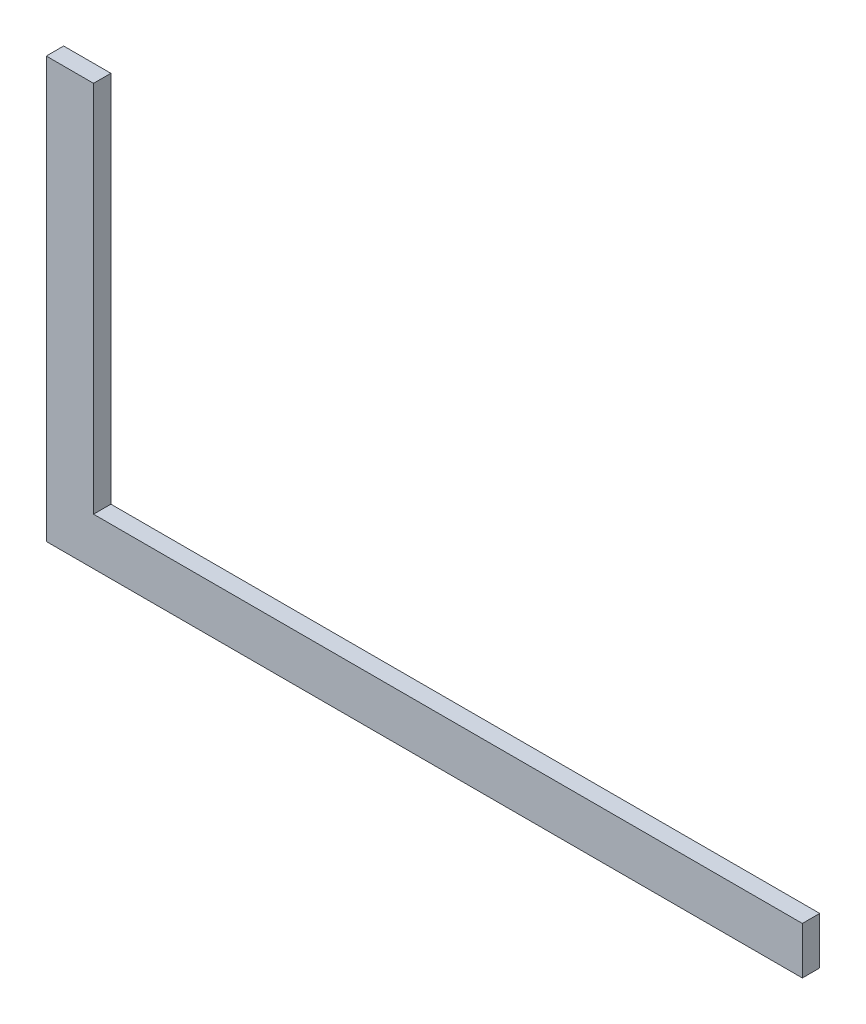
SolidWorks part; units mm, degrees
ref_plane "Front Plane" through (0, 0, 0) normal (0, 0, 1) x (1, 0, 0)
ref_plane "Top Plane" through (0, 0, 0) normal (0, 1, 0) x (1, 0, 0)
ref_plane "Right Plane" through (0, 0, 0) normal (1, 0, 0) x (0, 0, -1)
sketch "Sketch1" plane through (0, 0, 0) normal (0, 0, 1) x (1, 0, 0)
  line L1 (0, 0) -> (60.96, 0)
  line L3 (3.81, 3.81) -> (60.96, 3.81)
  line L4 (60.96, 0) -> (60.96, 3.81)
  line L6 (0, 0) -> (0, 33.8963)
  line L7 (0, 33.8963) -> (3.81, 33.8963)
  line L8 (3.81, 3.81) -> (3.81, 33.8963)
  dimension "D1" = 60.96
  dimension "D2" = 3.81
  dimension "D3" = 33.8963
  dimension "D4" = 3.81
extrude "Boss-Extrude1" add sketch "Sketch1" along normal blind 1.4
